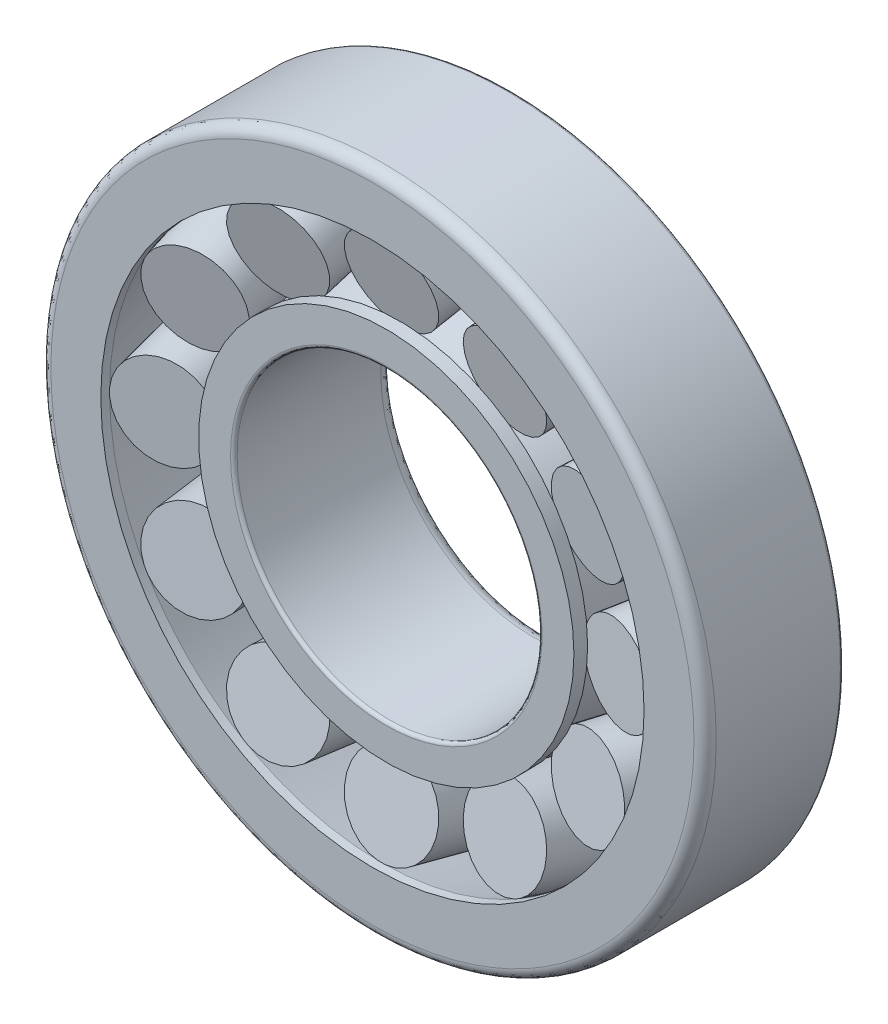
SolidWorks part; units mm, degrees
ref_plane "Front Plane" through (0, 0, 0) normal (0, 0, 1) x (1, 0, 0)
ref_plane "Top Plane" through (0, 0, 0) normal (0, 1, 0) x (1, 0, 0)
ref_plane "Right Plane" through (0, 0, 0) normal (1, 0, 0) x (0, 0, -1)
other "Configuration Table"
sketch "BaseSke" plane through (0, 0, 0) normal (1, 0, 0) x (0, 0, -1)
  line L0 (-47.2296, 0) -> (24.6132, 0) construction
  line L2 (0, 129.5214) -> (0, -86.3012) construction
  line L3 (4.5994, 48.448) -> (-36.0994, 39.052) construction
  line L4 (-31.5, 60) -> (-6.5, 60) construction
  line L5 (-29, 27.5) -> (0, 27.5) construction
  line L6 (-15.75, 43.75) -> (-21.8392, 70.1254) construction
  line L7 (-29.925, 49.0195) -> (-8.075, 54.6703)
  line L8 (-8.075, 54.6703) -> (-6.0698, 45.9848)
  line L9 (-6.0698, 45.9848) -> (-28.0527, 40.9097)
  line L10 (-28.0527, 40.9097) -> (-29.925, 49.0195)
  line L11 (-31.5, 60) -> (-31.5, 49) construction
  line L12 (-29.9205, 49) -> (-6.5, 55.057) construction
  line L13 (-6.5, 60) -> (-6.5, 55.057) construction
  line L14 (-29.9205, 49) -> (-31.5, 49) construction
  line L15 (-26.1804, 32.7999) -> (-4.0646, 37.2994) construction
  line L16 (-29, 27.5) -> (-29, 33.8499) construction
  line L17 (-29, 33.8499) -> (-26.5255, 33.8499) construction
  line L18 (0, 38.3494) -> (0, 27.5) construction
  line L19 (-26.5255, 33.8499) -> (-26.2897, 32.8287) construction
  line L20 (-26.2897, 32.8287) -> (-3.9778, 37.3681) construction
  line L21 (-3.9778, 37.3681) -> (-4.2044, 38.3494) construction
  line L22 (-4.2044, 38.3494) -> (0, 38.3494) construction
revolve "Roller" add sketch "BaseSke" angle 360 about L3
sketch "OuterRaceSke" plane through (0, 0, 0) normal (1, 0, 0) x (0, 0, -1)
  line L0 (-29.9205, 49) -> (-31.5, 49) construction
  line L1 (-29.9205, 49) -> (-6.5, 55.057) construction
  line L2 (-6.5, 60) -> (-6.5, 55.057) construction
  line L3 (-31.5, 60) -> (-6.5, 60) construction
  line L4 (-31.5, 60) -> (-31.5, 49) construction
  line L5 (-29.9205, 49) -> (-31.5, 49)
  line L6 (-29.9205, 49) -> (-6.5, 55.057)
  line L7 (-6.5, 60) -> (-6.5, 55.057)
  line L8 (-31.5, 60) -> (-6.5, 60)
  line L9 (-31.5, 60) -> (-31.5, 49)
  line L10 (-60.3939, 0) -> (35.9926, 0) construction
revolve "OuterRace" add sketch "OuterRaceSke" angle 360 about L10
sketch "InnerRaceSke" plane through (0, 0, 0) normal (1, 0, 0) x (0, 0, -1)
  line L0 (-29, 27.5) -> (0, 27.5) construction
  line L1 (-29, 27.5) -> (-29, 33.8499) construction
  line L2 (-29, 33.8499) -> (-26.5255, 33.8499) construction
  line L3 (-26.5255, 33.8499) -> (-26.2897, 32.8287) construction
  line L4 (-26.2897, 32.8287) -> (-3.9778, 37.3681) construction
  line L5 (-3.9778, 37.3681) -> (-4.2044, 38.3494) construction
  line L6 (-4.2044, 38.3494) -> (0, 38.3494) construction
  line L7 (0, 38.3494) -> (0, 27.5) construction
  line L8 (-29, 27.5) -> (0, 27.5)
  line L9 (-29, 27.5) -> (-29, 33.8499)
  line L10 (-29, 33.8499) -> (-26.5255, 33.8499)
  line L11 (-26.5255, 33.8499) -> (-26.2897, 32.8287)
  line L12 (-26.2897, 32.8287) -> (-3.9778, 37.3681)
  line L13 (-3.9778, 37.3681) -> (-4.2044, 38.3494)
  line L14 (-4.2044, 38.3494) -> (0, 38.3494)
  line L15 (0, 38.3494) -> (0, 27.5)
  line L16 (-58.1022, 0) -> (39.538, 0) construction
revolve "InnerRace" add sketch "InnerRaceSke" angle 360 about L16
fillet "Fillet1" radius 0.6 2 edges at (60, 0, 6.5) (27.5, 0, 29)
fillet "InnerFillet" radius 2.5 1 edges at (27.5, 0, 0)
fillet "OuterFillet" radius 2 1 edges at (60, 0, 31.5)
pattern_circular "CirPatternBall" count 12 over 360 about axis through (0, 0, 0) along (0, 0, 1) of "Roller"
sketch "Sketch4" plane through (0, 0, 0) normal (1, 0, 0) x (0, 0, -1)
  line L0 (-29.925, 49.0195) -> (-8.075, 54.6703)
  line L1 (-8.075, 54.6703) -> (-4.0646, 37.2994)
  line L2 (-4.0646, 37.2994) -> (-26.1804, 32.7999)
  line L3 (-26.1804, 32.7999) -> (-29.925, 49.0195)
  line L4 (-40.3293, 0) -> (19.5574, 0) construction
revolve "Simplified" [suppressed] add sketch "Sketch4" angle 360 about L4
equation "\"D2@BaseSke\" = \"Bearing_Thickness@BaseSke\"/2"
equation "\"D3@BaseSke\" =  ( \"Bearing_Outside_Diameter@BaseSke\" + \"Bearing_Inside_Diameter@BaseSke\" )  / 2"
equation "\"Roller_diameter@BaseSke\" = \"D3@BaseSke\"*1.12"
equation "\"D4@BaseSke\" = \"Bearing_Thickness@BaseSke\"/20"
equation "\"D5@BaseSke\" = \"Bearing_Thickness@BaseSke\" / 20"
equation "\"D8@BaseSke\" = \"Bearing_Thickness@BaseSke\"/30"
equation "\"D11@BaseSke\" = \"D8@BaseSke\""
equation "\"D1@CirPatternBall\" = int(  \"D3@BaseSke\" *  pi  /  ( \"Bearing_Outside_Diameter@BaseSke\" - \"Bearing_Inside_Diameter@BaseSke\" )  * 3 ) "
